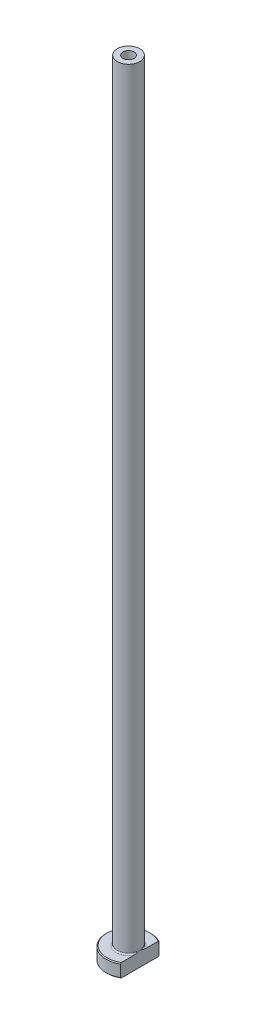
SolidWorks part; units mm, degrees
ref_plane "Front Plane" through (0, 0, 0) normal (0, 0, 1) x (1, 0, 0)
ref_plane "Top Plane" through (0, 0, 0) normal (0, 1, 0) x (1, 0, 0)
ref_plane "Right Plane" through (0, 0, 0) normal (1, 0, 0) x (0, 0, -1)
sketch "Sketch1" plane through (0, 0, 0) normal (0, 0, 1) x (1, 0, 0)
  line L0 (-1.25, 175) -> (-2.5, 175)
  line L1 (-2.5, 175) -> (-2.5, 3)
  line L2 (-2.5, 3) -> (-5, 3)
  line L3 (-5, 3) -> (-5, 0)
  line L4 (4.125, 0) -> (-4.125, 0) construction
  line L5 (-5, 0) -> (-1.5, 0)
  line L6 (-1.25, 140) -> (-1.25, 175)
  line L7 (0, 92.1877) -> (0, -15.5353) construction
  line L8 (0, -5.5) -> (0, 5.5) construction
  line L9 (-1.25, 140) -> (-1.5, 128)
  line L10 (-1.5, 128) -> (-1.5, 0)
  dimension "D1" = 0.25
  dimension "ID" = 2.5
  dimension "OD" = 5
  dimension "L" = 175
  dimension "H" = 10
  dimension "T" = 3
  dimension "N" = 35
  dimension "D2" = 12
  dimension "L-N" = 140
revolve "Revolve1" add sketch "Sketch1" angle 360 about L7
fillet "Fillet1" radius 0.3 1 edges at (0, 3, 2.5)
chamfer "Chamfer1" distance 0.2 angle 45 2 edges at (0, 3, 5) (0, 0, 5)
sketch "Sketch2" plane through (0, 0, 0) normal (0, -1, 0) x (1, 0, 0)
  line L0 (2.5, 4.3301) -> (2.5, -4.3301)
  circle A0 centre (0, 0) radius 5 construction
  arc A1 (2.5, 4.3301) -> (2.5, -4.3301) centre (0, 0) cw
  circle A2 centre (0, 0) radius 2.5 construction
extrude "Cut-Extrude1" cut sketch "Sketch2" against normal through all
chamfer "Chamfer2" distance 0.5 angle 45 1 edges at (0, 0, 1.5)
